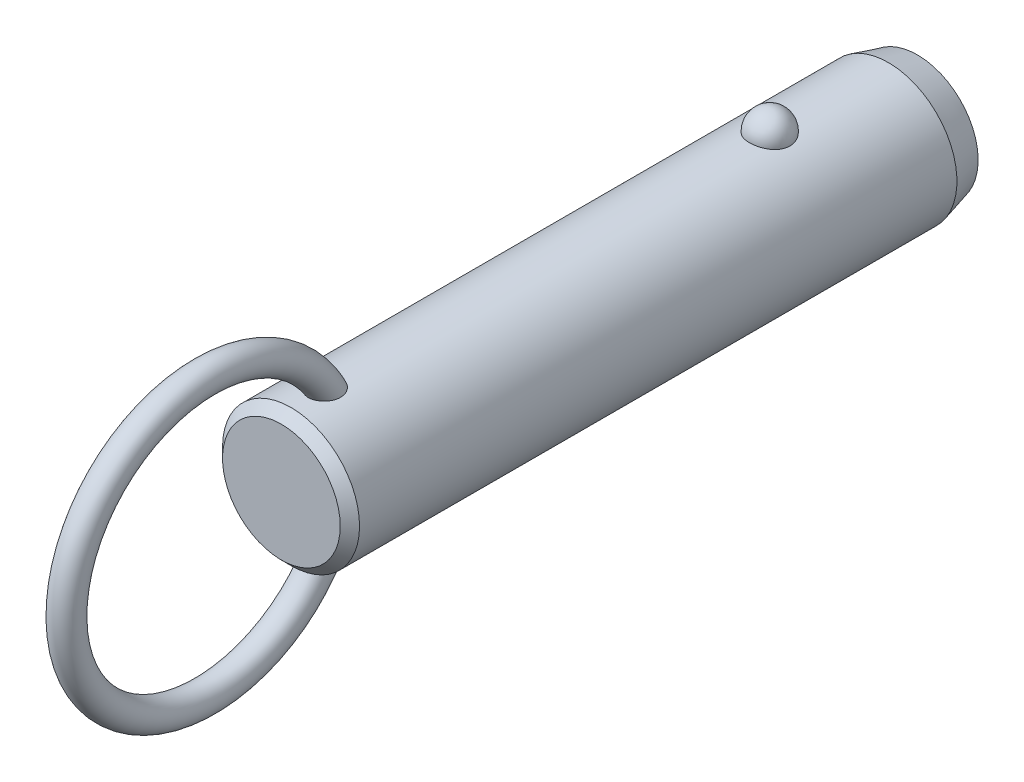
SolidWorks part; units mm, degrees
ref_plane "Front Plane" through (0, 0, 0) normal (0, 0, 1) x (1, 0, 0)
ref_plane "Top Plane" through (0, 0, 0) normal (0, 1, 0) x (1, 0, 0)
ref_plane "Right Plane" through (0, 0, 0) normal (1, 0, 0) x (0, 0, -1)
sketch "Sketch2" plane through (0, 0, 0) normal (0, 0, 1) x (1, 0, 0)
  circle A0 centre (0, 0) radius 7.1
  point P3 (0, 7.1)
  dimension "D1" = 14.2
extrude "Boss-Extrude1" add sketch "Sketch2" along normal blind 40.6
sketch "Sketch3" plane through (0, 0, 0) normal (0, 0, -1) x (-1, 0, 0)
  circle A0 centre (0, 0) radius 7.1
  dimension "D1" = 14.2
extrude "Boss-Extrude2" add sketch "Sketch3" along normal blind 17.4
chamfer "Chamfer1" distance 3 angle 15 1 edges at (-7.1, 0, -17.4)
sketch "Sketch12" plane through (0, 0, 0) normal (1, 0, 0) x (0, 0, -1)
  line L0 (-40.6, 7.1) -> (-40.6, -7.1) construction
  point P0 (-40.6, 0)
sketch "Sketch13" plane through (0, 0, 0) normal (1, 0, 0) x (0, 0, -1)
  circle A0 centre (-56.45, 0) radius 15.85
  point P2 (-40.6, 0)
  dimension "D1" = 31.7
sketch "Sketch14" plane through (0, 0, 0) normal (0, 1, 0) x (1, 0, 0)
  circle A0 centre (0, -42.1) radius 1.5
  point P2 (0, -40.6)
  dimension "D1" = 3
sweep "Sweep1" add profiles "Sketch14" path "Sketch13"
sketch "Sketch15" plane through (0, 0, 40.6) normal (0, 0, 1) x (1, 0, 0)
  circle A0 centre (0, 0) radius 7.1
  dimension "D1" = 14.2
extrude "Boss-Extrude3" add sketch "Sketch15" along normal blind 7.92
chamfer "Chamfer2" distance 1 angle 45 1 edges at (7.1, 0, 48.52)
sketch "Sketch18" plane through (0, 0, 0) normal (1, 0, 0) x (0, 0, -1)
  line L0 (14.4, 7.1) -> (-42.2792, 7.1) construction
  line L1 (2.1, 9.2) -> (2.1, 5)
  line L2 (-42.2792, -7.1) -> (14.4, -7.1) construction
  arc A0 (2.1, 9.2) -> (2.1, 5) centre (2.1, 7.1) ccw
  point P4 (0, 7.1)
  dimension "D1" = 16.3
revolve "Revolve1" add sketch "Sketch18" angle 360 about L1
